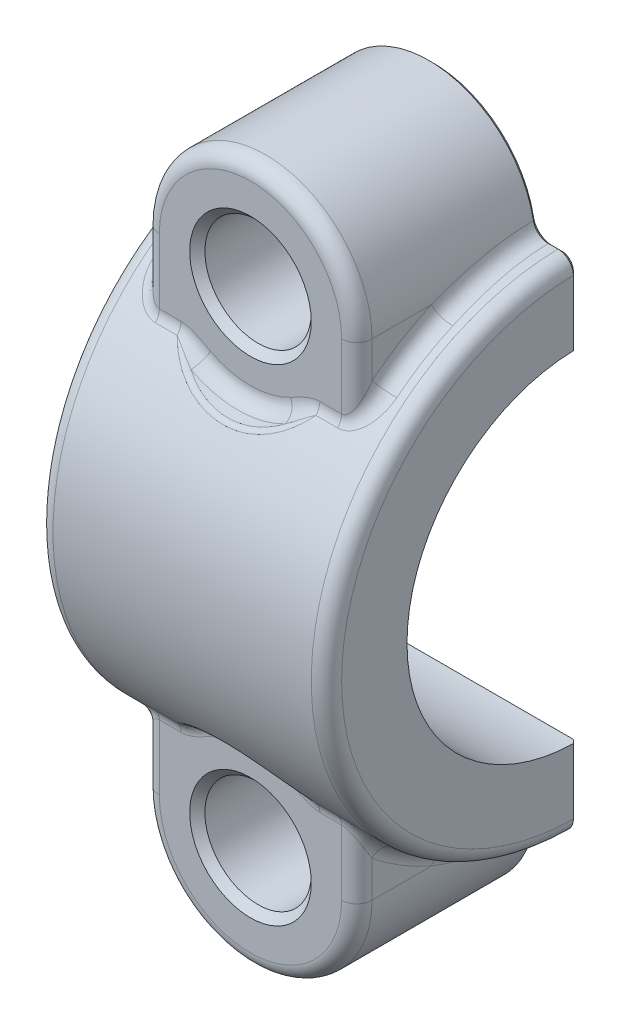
SolidWorks part; units mm, degrees
ref_plane "Plan1" through (0, 0, 0) normal (0, 0, 1) x (1, 0, 0)
ref_plane "Plan2" through (0, 0, 0) normal (0, 1, 0) x (1, 0, 0)
ref_plane "Plan3" through (0, 0, 0) normal (1, 0, 0) x (0, 0, -1)
sketch "Esquisse1" plane through (0, 0, 0) normal (0, 0, 1) x (1, 0, 0)
  line L0 (0, 0) -> (61.5263, 0) construction
  line L1 (42.4403, 0) -> (38.1195, 0) construction
  line L7 (22, 11.2) -> (22, 11.1982)
  line L8 (22, 11.1982) -> (41, 11.1982)
  line L9 (41, 11.1982) -> (41, 11.2)
  line L10 (41, 11.2) -> (41, 15.5)
  line L11 (40, 16.5) -> (39.3581, 16.5)
  line L12 (23.6419, 16.5) -> (23, 16.5)
  line L13 (22, 15.5) -> (22, 11.2)
  line L14 (22, 11.2) -> (22, 11.1982)
  line L15 (22, 11.1982) -> (41, 11.1982)
  line L16 (41, 11.1982) -> (41, 11.2)
  line L17 (41, 11.2) -> (41, 15.5)
  line L18 (40, 16.5) -> (39.3581, 16.5)
  line L19 (39.3581, 16.5) -> (23, 16.5)
  line L20 (22, 15.5) -> (22, 11.2)
  arc A5 (41, 15.5) -> (40, 16.5) centre (40, 15.5) ccw
  arc A6 (38.3759, 17.3125) -> (39.3581, 16.5) centre (39.3581, 17.5) ccw
  arc A7 (38.3759, 17.3125) -> (24.6241, 17.3125) centre (31.5, 16) ccw
  arc A8 (23.6419, 16.5) -> (24.6241, 17.3125) centre (23.6419, 17.5) ccw
  arc A9 (23, 16.5) -> (22, 15.5) centre (23, 15.5) ccw
  arc A10 (41, 15.5) -> (40, 16.5) centre (40, 15.5) ccw
  arc A14 (23, 16.5) -> (22, 15.5) centre (23, 15.5) ccw
  dimension "D1" = 0
revolve "Base-Révolution" add sketch "Esquisse1" angle 180 about L0
sketch "Esquisse2" plane through (0, 0, 0) normal (0, 0, 1) x (1, 0, 0)
  line L0 (22, 11.1982) -> (41, 11.1982) construction
  line L1 (24.5, 11.1982) -> (38.5, 11.1982)
  line L2 (41, -11.1982) -> (22, -11.1982) construction
  line L3 (38.5, -11.1982) -> (24.5, -11.1982)
  line L4 (24.5, 16) -> (24.5, 11.1982)
  line L5 (38.5, 16) -> (38.5, 11.1982)
  line L6 (24.5, -16) -> (24.5, -11.1982)
  line L7 (38.5, -16) -> (38.5, -11.1982)
  arc A0 (38.3759, 17.3125) -> (24.6241, 17.3125) centre (31.5, 16) ccw construction
  arc A1 (38.5, 16) -> (24.5, 16) centre (31.5, 16) ccw
  arc A2 (24.6241, -17.3125) -> (38.3759, -17.3125) centre (31.5, -16) ccw construction
  arc A3 (24.5, -16) -> (38.5, -16) centre (31.5, -16) ccw
extrude "Boss.-Extru.1" add sketch "Esquisse2" along normal blind 12
sketch "Esquisse3" plane through (0, 0, 12) normal (0, 0, 1) x (1, 0, 0)
  circle A0 centre (31.5, 16) radius 6.5
  circle A1 centre (31.5, -16) radius 6.5
  dimension "D1" = 13
  dimension "D2" = 13
extrude "Enlèv. mat.-Extru.1" cut sketch "Esquisse3" along normal through all draft 10
sketch "Esquisse4" plane through (0, 0, 12) normal (0, 0, 1) x (1, 0, 0)
  circle A0 centre (31.5, 16) radius 3.5
  circle A1 centre (31.5, -16) radius 3.5
  dimension "D1" = 7
  dimension "D2" = 7
extrude "Enlèv. mat.-Extru.2" cut sketch "Esquisse4" against normal through all
fillet "Congé1" radius 0.5
fillet "Congé2" radius 1
fillet "Congé3" radius 1
chamfer "Chanfrein1" distance 0.25 angle 45
chamfer "Chanfrein2" distance 0.5 angle 45
